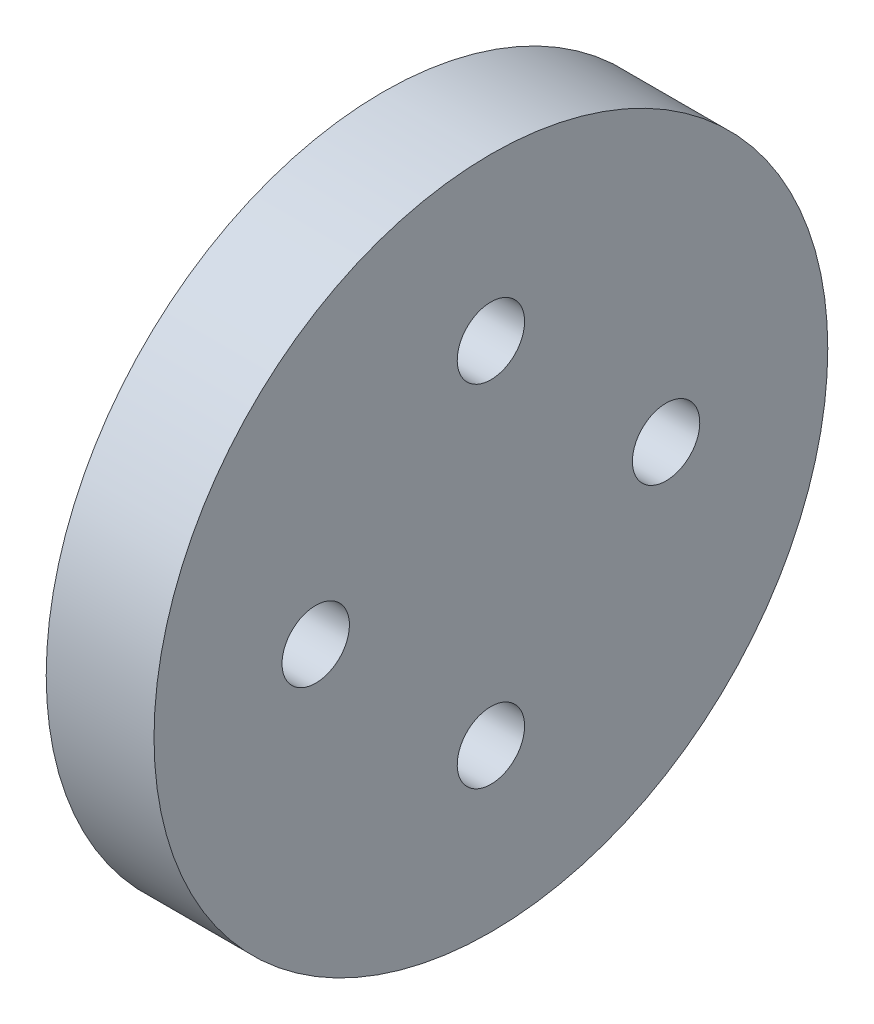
SolidWorks part; units mm, degrees
ref_plane "Face" through (0, 0, 0) normal (0, 0, 1) x (1, 0, 0)
ref_plane "Dessus" through (0, 0, 0) normal (0, 1, 0) x (1, 0, 0)
ref_plane "Droite" through (0, 0, 0) normal (1, 0, 0) x (0, 0, -1)
sketch "Esquisse1" plane through (0, 0, 0) normal (0, 0, 1) x (1, 0, 0)
  line L0 (0, 0) -> (-10, 0) construction
  line L1 (0, 0) -> (0, 12.5)
  line L2 (0, 12.5) -> (-4, 12.5)
  line L3 (-4, 12.5) -> (-4, 4)
  line L4 (-4, 4) -> (-8, 4)
  line L5 (-8, 4) -> (-9, 3)
  line L6 (-9, 3) -> (-9, 0)
  line L7 (0, 0) -> (-9, 0)
  dimension "D1" = 4
  dimension "D2" = 9
  dimension "D3" = 45
  dimension "D4" = 1
  dimension "D5" = 25
  dimension "D6" = 8
revolve "Base-Révolution" add sketch "Esquisse1" angle 360 about L0
sketch "Esquisse2" plane through (0, 0, 0) normal (1, 0, 0) x (0, 0, -1)
  circle A0 centre (-6.5, 0) radius 1.25
  circle A1 centre (6.5, 0) radius 1.25
  circle A2 centre (0, -6.5) radius 1.25
  circle A3 centre (0, 6.5) radius 1.25
  circle A4 centre (0, 0) radius 6.5 construction
  dimension "D5" = 2.5
  dimension "D6" = 13
  dimension "D1" = 6.5
  dimension "D2" = 6.5
  dimension "D3" = 6.5
  dimension "D4" = 6.5
extrude "Enlèv. mat.-Extru.1" cut sketch "Esquisse2" against normal through all
